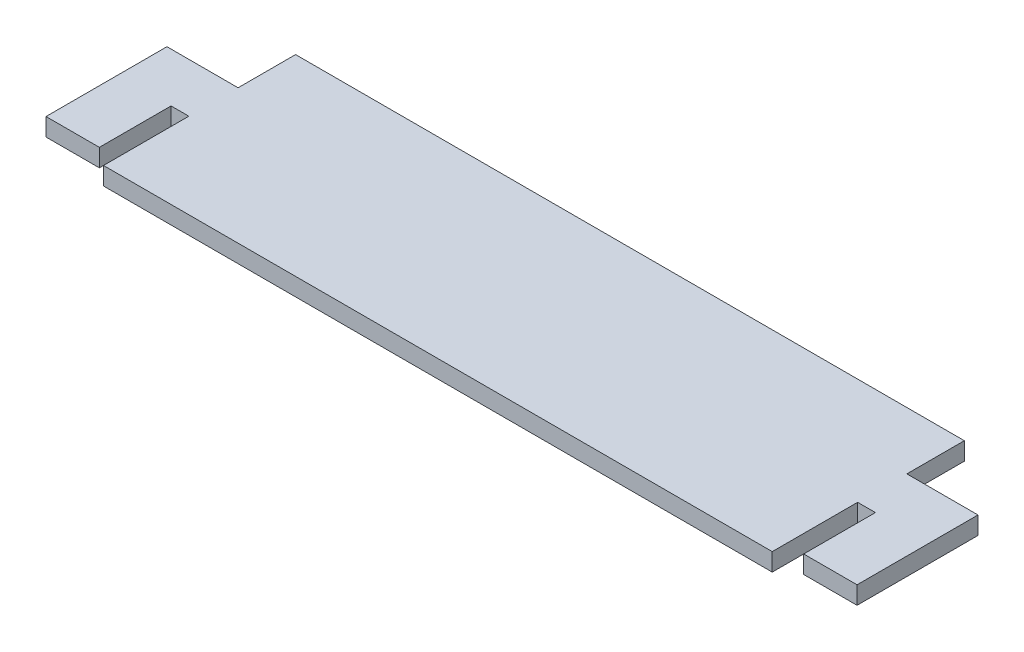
SolidWorks part; units mm, degrees
ref_plane "Front" through (0, 0, 0) normal (0, 0, 1) x (1, 0, 0)
ref_plane "Top" through (0, 0, 0) normal (0, 1, 0) x (1, 0, 0)
ref_plane "Right" through (0, 0, 0) normal (1, 0, 0) x (0, 0, -1)
sketch "Sketch1" plane through (0, 0, 0) normal (0, 1, 0) x (1, 0, 0)
  line L0 (-235, -7.5) -> (235, -7.5) construction
  line L1 (-235, 67.5) -> (235, 67.5)
  line L2 (-235, 67.5) -> (-235, 27.0994)
  line L3 (-235, -67.5) -> (235, -67.5)
  line L4 (235, 67.5) -> (235, 27.0994)
  line L5 (-235, 67.5) -> (235, -67.5) construction
  line L6 (-235, -67.5) -> (235, 67.5) construction
  line L7 (-235, 27.0994) -> (-285, 27.0994)
  line L8 (-285, 27.0994) -> (-285, -57.9006)
  line L9 (-285, -57.9006) -> (-247.5, -57.9006)
  line L10 (-247.5, -57.9006) -> (-247.5, -7.5)
  line L11 (-247.5, -7.5) -> (-235, -7.5)
  line L12 (0, 67.5) -> (0, -67.5) construction
  line L13 (247.5, -7.5) -> (235, -7.5)
  line L14 (285, -57.9006) -> (247.5, -57.9006)
  line L15 (247.5, -57.9006) -> (247.5, -7.5)
  line L16 (235, 27.0994) -> (285, 27.0994)
  line L17 (285, 27.0994) -> (285, -57.9006)
  line L18 (-235, -7.5) -> (-235, -67.5)
  line L19 (235, -7.5) -> (235, -67.5)
  point P0 (0, 0)
  dimension "D1" = 470
  dimension "D2" = 135
  dimension "D3" = 50
  dimension "D4" = 12.5
  dimension "D5" = 85
extrude "Boss-Extrude1" add sketch "Sketch1" along normal blind 12.5 contours L7 L8 L9 L10 L11 L18 L3 L19 L13 L15 L14 L17 L16 L4 L1 L2
